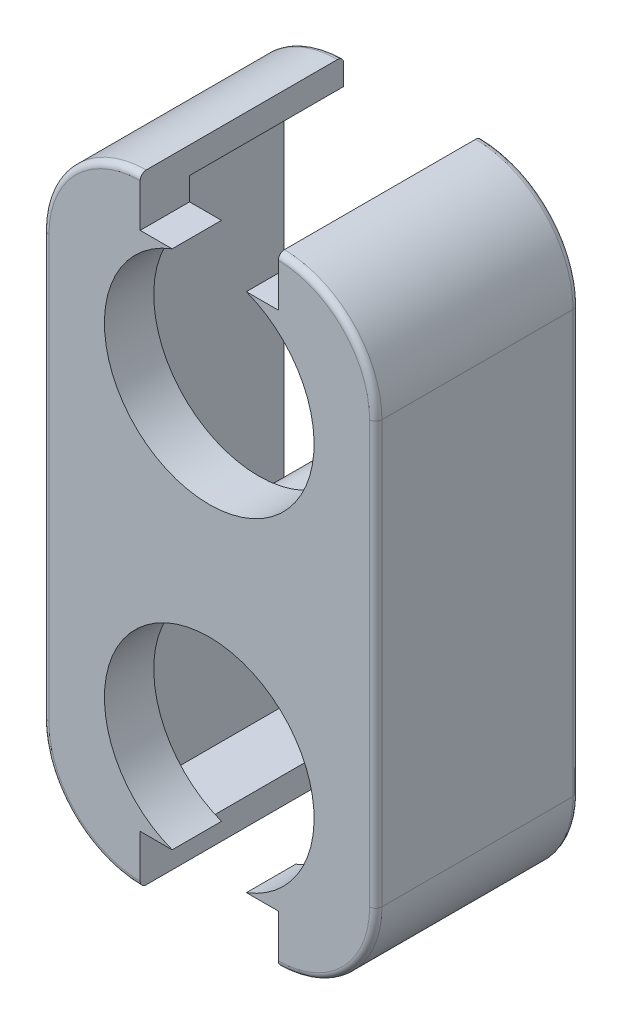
SolidWorks part; units mm, degrees
ref_plane "Front Plane" through (0, 0, 0) normal (0, 0, 1) x (1, 0, 0)
ref_plane "Top Plane" through (0, 0, 0) normal (0, 1, 0) x (1, 0, 0)
ref_plane "Right Plane" through (0, 0, 0) normal (1, 0, 0) x (0, 0, -1)
sketch "草图1" plane through (0, 0, 0) normal (0, 0, 1) x (1, 0, 0)
  line L1 (-13.5, 25.1) -> (13.5, 25.1)
  line L2 (-13.5, 25.1) -> (-13.5, -25.1)
  line L3 (-13.5, -25.1) -> (13.5, -25.1)
  line L4 (13.5, 25.1) -> (13.5, -25.1)
  line L5 (-13.5, 25.1) -> (13.5, -25.1) construction
  line L6 (-13.5, -25.1) -> (13.5, 25.1) construction
  point P0 (0, 0)
  dimension "D1" = 50.2
  dimension "D2" = 27
extrude "凸台-拉伸1" add sketch "草图1" along normal blind 16.5
sketch "草图2" plane through (0, 0, 16.5) normal (0, 0, 1) x (1, 0, 0)
  line L0 (0, 0) -> (-36.8055, 0) construction
  line L1 (0, 0) -> (0, 42.2) construction
  line L2 (13.5, 25.1) -> (-13.5, 25.1) construction
  line L3 (5.6, 25.1) -> (-5.6, 25.1)
  line L4 (5.6, 25.1) -> (5.6, 21.1)
  line L5 (5.6, 21.1) -> (3.0079, 21.1)
  line L6 (-5.6, 25.1) -> (-5.6, 21.1)
  line L7 (5.6, -25.1) -> (5.6, -21.1)
  line L8 (5.6, -21.1) -> (3.0079, -21.1)
  line L9 (5.6, -25.1) -> (-5.6, -25.1)
  line L10 (-5.6, -25.1) -> (-5.6, -21.1)
  line L11 (-3.0079, -21.1) -> (-5.6, -21.1)
  line L12 (-3.0079, 21.1) -> (-5.6, 21.1)
  arc A0 (-3.0079, 21.1) -> (3.0079, 21.1) centre (0, 13.15) ccw
  arc A1 (3.0079, -21.1) -> (-3.0079, -21.1) centre (0, -13.15) ccw
  dimension "D1" = 17
  dimension "D2" = 26.3
  dimension "D3" = 13.15
  dimension "D4" = 11.2
  dimension "D5" = 4
extrude "切除-拉伸1" cut sketch "草图2" against normal up to next
sketch "草图3" plane through (0, 0, 0) normal (0, 0, -1) x (-1, 0, 0)
  line L1 (10.45, 22.95) -> (-10.45, 22.95)
  line L2 (10.45, 22.95) -> (10.45, -22.95)
  line L3 (10.45, -22.95) -> (-10.45, -22.95)
  line L4 (-10.45, 22.95) -> (-10.45, -22.95)
  line L5 (10.45, 22.95) -> (-10.45, -22.95) construction
  line L6 (10.45, -22.95) -> (-10.45, 22.95) construction
  point P1 (0, 0)
  dimension "D1" = 45.9
  dimension "D2" = 20.9
extrude "切除-拉伸2" cut sketch "草图3" against normal blind 12.5
sketch "草图4" plane through (0, 0, 12.5) normal (0, 0, -1) x (-1, 0, 0)
  circle A0 centre (0, 0) radius 2.5
  dimension "D1" = 5
extrude "凸台-拉伸2" add sketch "草图4" along normal blind 8.5
fillet "圆角1" radius 8 4 edges at (13.5, -25.1, 8.25) (-13.5, -25.1, 8.25) (13.5, 25.1, 8.25) (-13.5, 25.1, 8.25)
fillet "圆角2" radius 0.5 12 edges at (11.1921, -22.722, 0) (11.1921, 22.722, 0) (-11.1921, 22.722, 0) (-11.1921, -22.722, 0) (11.1921, -22.722, 16.5) (11.1921, 22.722, 16.5) (-11.1921, 22.722, 16.5) (-11.1921, -22.722, 16.5) (13.5, 0, 0) (-13.5, 0, 0) (13.5, 0, 16.5) (-13.5, 0, 16.5)
